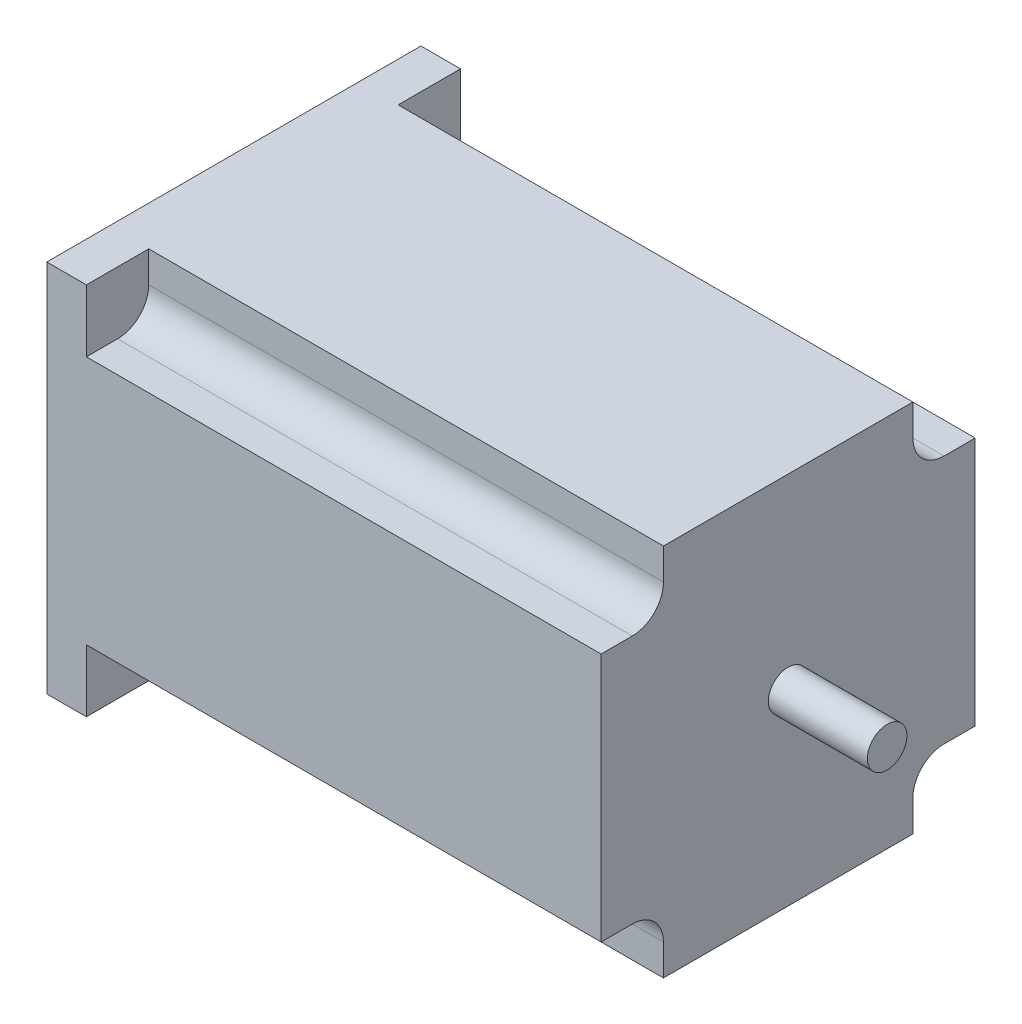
SolidWorks part; units mm, degrees
ref_plane "Front Plane" through (0, 0, 0) normal (0, 0, 1) x (1, 0, 0)
ref_plane "Top Plane" through (0, 0, 0) normal (0, 1, 0) x (1, 0, 0)
ref_plane "Right Plane" through (0, 0, 0) normal (1, 0, 0) x (0, 0, -1)
ref_plane "Plane1" through (88.9, 0, 0) normal (1, 0, 0) x (0, 0, -1)
sketch "Sketch2" plane through (88.9, 0, 0) normal (1, 0, 0) x (0, 0, -1)
  line L0 (30, 30) -> (-30, 30)
  line L1 (-30, 30) -> (-30, -30)
  line L2 (-30, -30) -> (30, -30)
  line L3 (30, -30) -> (30, 30)
  dimension "D1" = 60
  dimension "D2" = 60
extrude "Boss-Extrude2" add sketch "Sketch2" against normal blind 88.9
sketch "Sketch6" plane through (88.9, 0, 0) normal (1, 0, 0) x (0, 0, -1)
  line L1 (30, 30) -> (20, 30)
  line L2 (30, 30) -> (30, 20)
  line L3 (30, 20) -> (25, 20)
  line L4 (20, 30) -> (20, 25)
  arc A0 (25, 20) -> (20, 25) centre (25, 25) cw
  point P7 (20, 20)
  dimension "D3" = 5
  dimension "D1" = 10
  dimension "D2" = 10
extrude "Cut-Extrude1" cut sketch "Sketch6" against normal blind 82.55
mirror "Mirror1" about plane through (0, 0, 0) normal (0, 1, 0) of "Cut-Extrude1"
mirror "Mirror2" about plane through (0, 0, 0) normal (0, 0, 1) of "Mirror1", "Cut-Extrude1"
sketch "Sketch7" plane through (0, 0, 0) normal (1, 0, 0) x (0, 0, -1)
  circle A0 centre (0, 0) radius 19.05
  dimension "D1" = 38.1
extrude "Boss-Extrude3" add sketch "Sketch7" against normal blind 1.5
sketch "Sketch11" plane through (-1.5, 0, 0) normal (-1, 0, 0) x (0, 0, 1)
  circle A0 centre (0, 0) radius 3.175
extrude "Boss-Extrude4" add sketch "Sketch11" along normal blind 22.225
sketch "Sketch12" plane through (88.9, 0, 0) normal (1, 0, 0) x (0, 0, -1)
  circle A0 centre (0, 0) radius 3.175
extrude "Boss-Extrude5" add sketch "Sketch12" along normal blind 15.875
